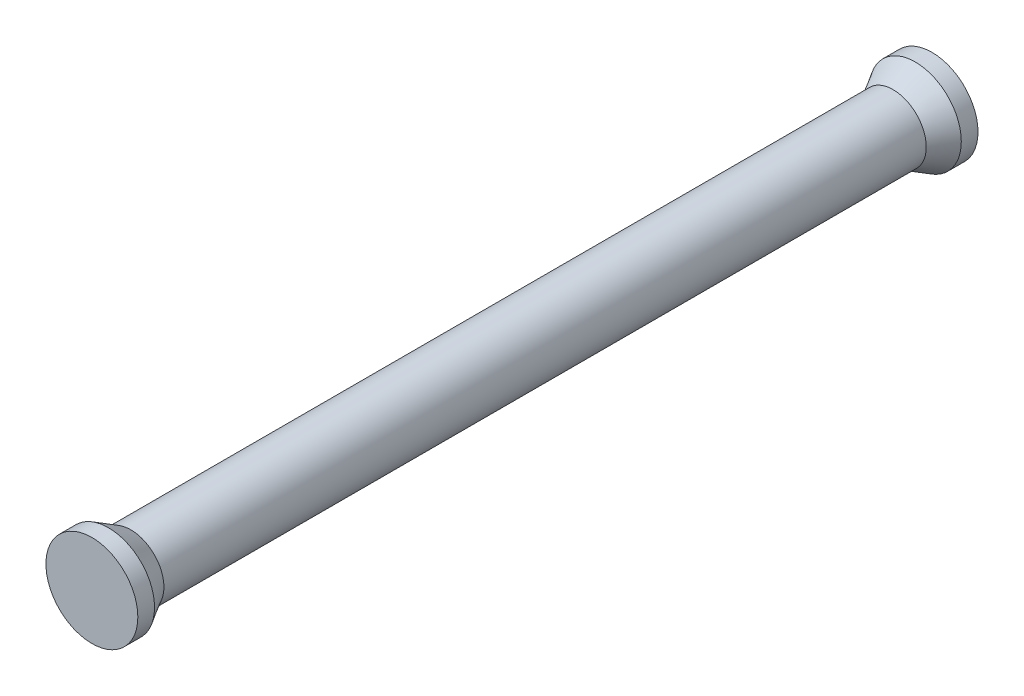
SolidWorks part; units mm, degrees
ref_plane "Спереди" through (0, 0, 0) normal (0, 0, 1) x (1, 0, 0)
ref_plane "Сверху" through (0, 0, 0) normal (0, 1, 0) x (1, 0, 0)
ref_plane "Справа" through (0, 0, 0) normal (1, 0, 0) x (0, 0, -1)
sketch "Эскиз1" plane through (0, 0, 0) normal (1, 0, 0) x (0, 0, -1)
  line L0 (0, 0) -> (76.2052, 0) construction
  line L1 (0, 0) -> (59.8932, 0)
  line L2 (59.8932, 0) -> (59.8932, 3.2766)
  line L3 (59.8932, 3.2766) -> (58.7026, 3.2766)
  line L4 (58.7026, 3.2766) -> (57.1188, 2.3622)
  line L5 (57.1188, 2.3622) -> (2.7744, 2.3622)
  line L6 (2.7744, 2.3622) -> (1.1906, 3.2766)
  line L7 (1.1906, 3.2766) -> (0, 3.2766)
  line L8 (0, 3.2766) -> (0, 0)
  dimension "D1" = 59.8932
  dimension "D2" = 30
  dimension "D3" = 30
  dimension "D4" = 4.7244
  dimension "D5" = 6.5532
  dimension "D6" = 1.1906
  dimension "D7" = 1.1906
revolve "Повернуть1" add sketch "Эскиз1" angle 360 about L0
